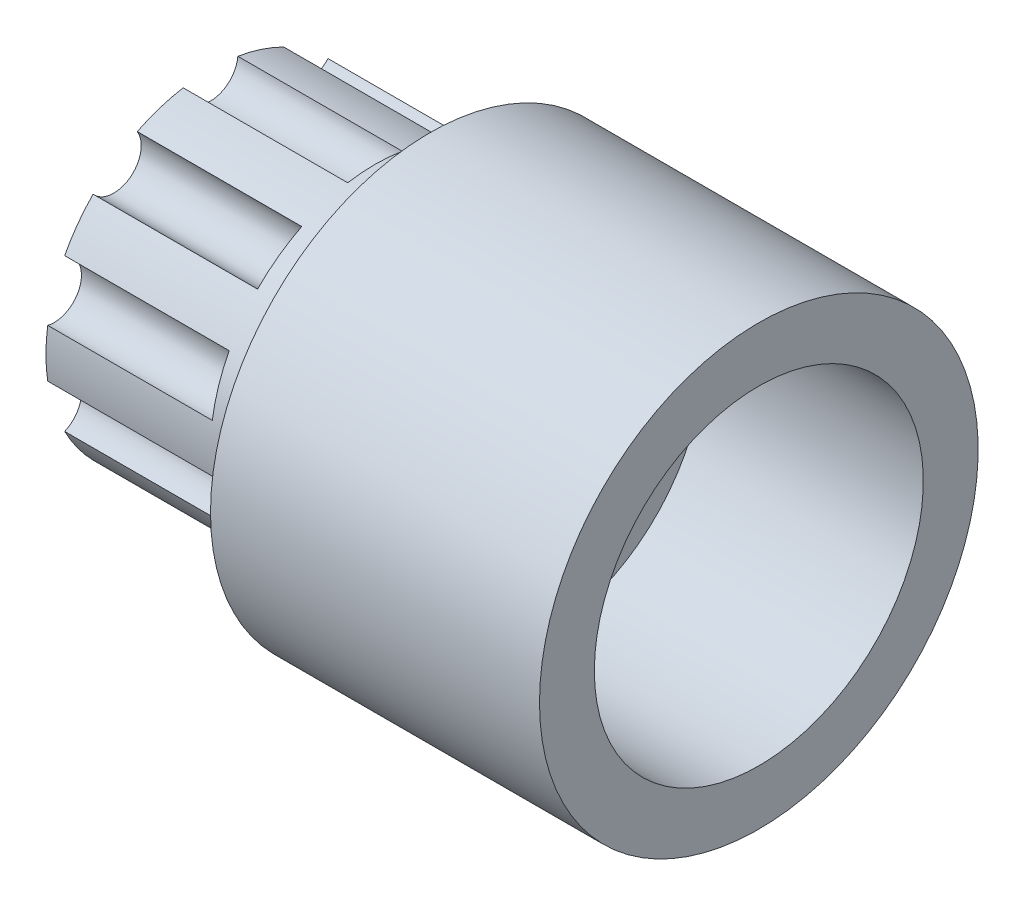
SolidWorks part; units mm, degrees
ref_plane "Plan de face" through (0, 0, 0) normal (0, 0, 1) x (1, 0, 0)
ref_plane "Plan de dessus" through (0, 0, 0) normal (0, 1, 0) x (1, 0, 0)
ref_plane "Plan de droite" through (0, 0, 0) normal (1, 0, 0) x (0, 0, -1)
sketch "Esquisse1" plane through (0, 0, 0) normal (0, 0, 1) x (1, 0, 0)
  line L0 (-58.3639, 0) -> (0, 0) construction
  line L1 (0, 4) -> (-6, 4)
  line L2 (-6, 4) -> (-6, 3)
  line L3 (-6, 3) -> (-10, 3)
  line L4 (-10, 3) -> (-10, 2)
  line L5 (-10, 2) -> (-4, 2)
  line L6 (0, 3) -> (0, 4)
  line L7 (-4, 2) -> (-4, 3)
  line L8 (-4, 3) -> (0, 3)
  dimension "D1" = 4
  dimension "D2" = 3
  dimension "D3" = 6
  dimension "D4" = 2
  dimension "D5" = 4
  dimension "D6" = 4
revolve "Révolution1" add sketch "Esquisse1" angle 360 about L0
sketch "Esquisse2" plane through (-10, 0, 0) normal (-1, 0, 0) x (0, 0, 1)
  line L0 (0, -4.4) -> (0, 4.4) construction
  circle A0 centre (0, 3) radius 0.5
  circle A1 centre (0, 0) radius 3 construction
  dimension "D1" = 1
extrude "Extrusion1" cut sketch "Esquisse2" against normal offset from surface (3 mm away) 1
pattern_circular "Répétition circulaire1" count 10 every 36 about axis through (0, 0, 0) along (1, 0, 0) of "Extrusion1"
